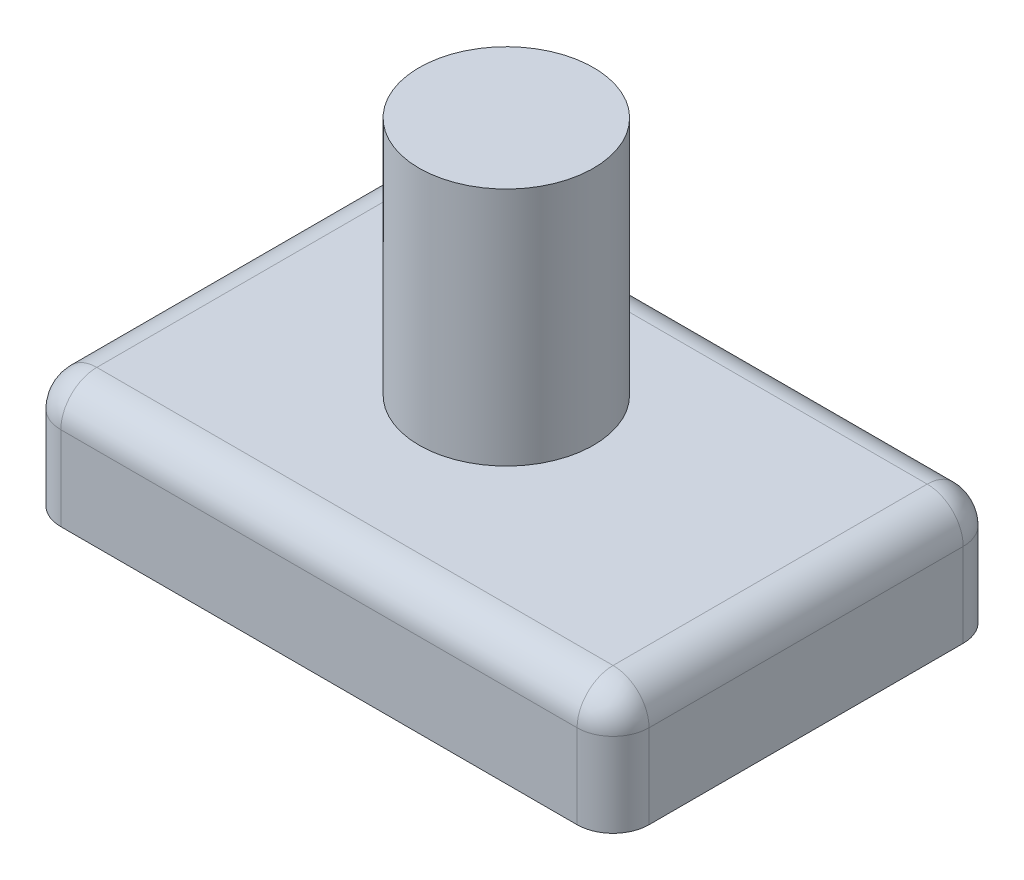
SolidWorks part; units mm, degrees
ref_plane "Front Plane" through (0, 0, 0) normal (0, 0, 1) x (1, 0, 0)
ref_plane "Top Plane" through (0, 0, 0) normal (0, 1, 0) x (1, 0, 0)
ref_plane "Right Plane" through (0, 0, 0) normal (1, 0, 0) x (0, 0, -1)
sketch "Sketch1" plane through (0, 0, 0) normal (0, 1, 0) x (1, 0, 0)
  line L1 (-56.0243, 35.8267) -> (68.5275, 35.8267)
  line L2 (-56.0243, 35.8267) -> (-56.0243, -45.9255)
  line L3 (-56.0243, -45.9255) -> (68.5275, -45.9255)
  line L4 (68.5275, 35.8267) -> (68.5275, -45.9255)
extrude "Extrude1" add sketch "Sketch1" along normal blind 25.4
sketch "Sketch2" plane through (0, 25.4, 0) normal (0, 1, 0) x (-1, 0, 0)
  circle A0 centre (0, 0) radius 18.4626
extrude "Extrude2" add sketch "Sketch2" along normal blind 50.8
fillet "Fillet2" radius 7.62 4 edges at (-56.0243, 12.7, -35.8267) (68.5275, 12.7, -35.8267) (68.5275, 12.7, 45.9255) (-56.0243, 12.7, 45.9255)
fillet "Fillet3" radius 7.62 8 edges at (6.2516, 25.4, -35.8267) (68.5275, 25.4, 5.0494) (-56.0243, 25.4, 5.0494) (6.2516, 25.4, 45.9255) (-53.7924, 25.4, 43.6936) (-53.7924, 25.4, -33.5948) (66.2957, 25.4, 43.6936) (66.2957, 25.4, -33.5948)
